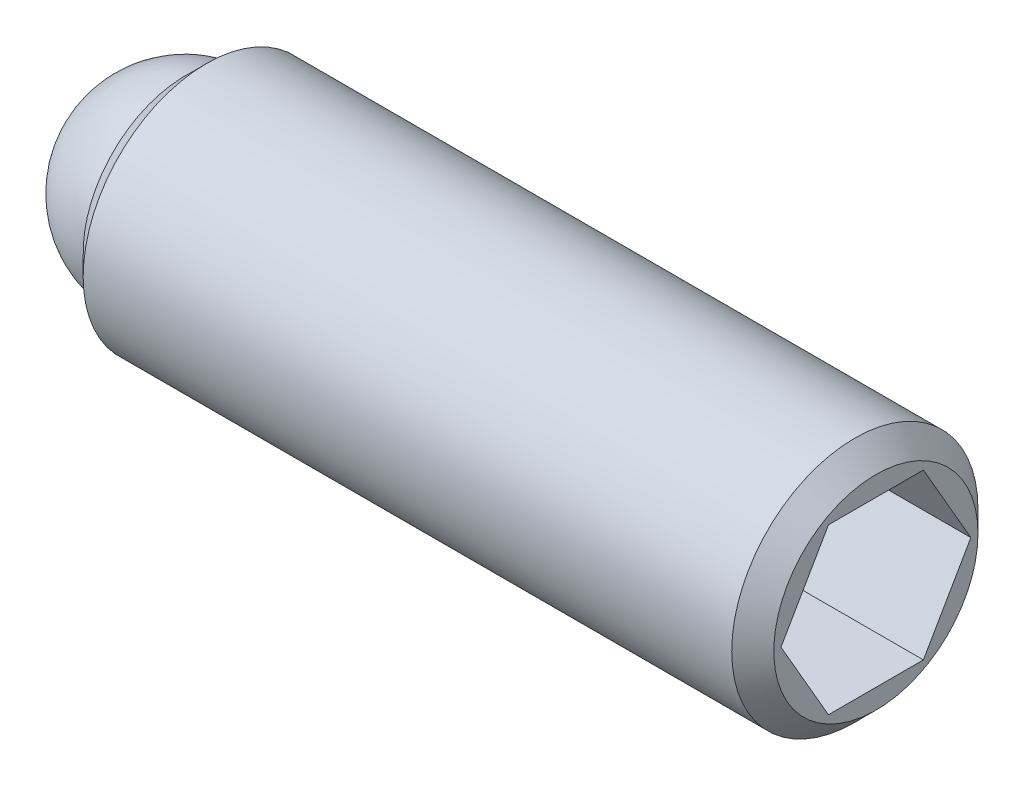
SolidWorks part; units mm, degrees
ref_plane "Front Plane" through (0, 0, 0) normal (0, 0, 1) x (1, 0, 0)
ref_plane "Top Plane" through (0, 0, 0) normal (0, 1, 0) x (1, 0, 0)
ref_plane "Right Plane" through (0, 0, 0) normal (1, 0, 0) x (0, 0, -1)
sketch "Sketch2" plane through (0, 0, 0) normal (1, 0, 0) x (0, 0, -1)
  circle A0 centre (0, 0) radius 1.4859
  dimension "D1" = 2.9718
extrude "Boss-Extrude1" add sketch "Sketch2" along normal blind 8.3344
sketch "Sketch3" plane through (0, 0, 0) normal (-1, 0, 0) x (0, 0, 1)
  circle A0 centre (0, 0) radius 1.1906
  dimension "D1" = 2.3813
chamfer "Chamfer1" distance 0.254 angle 45 1 edges at (0, 0, -1.4859)
chamfer "Chamfer2" distance 0.254 angle 45 1 edges at (8.3344, 0, -1.4859)
sketch "Sketch4" plane through (8.3344, 0, 0) normal (1, 0, 0) x (0, 0, -1)
  line L1 (1.1457, 0) -> (0.5728, 0.9922)
  line L2 (0.5728, 0.9922) -> (-0.5728, 0.9922)
  line L3 (-0.5728, 0.9922) -> (-1.1457, 0)
  line L4 (-1.1457, 0) -> (-0.5728, -0.9922)
  line L5 (-0.5728, -0.9922) -> (0.5728, -0.9922)
  line L6 (0.5728, -0.9922) -> (1.1457, 0)
  circle A0 centre (0, 0) radius 0.9922 construction
extrude "Cut-Extrude2" cut sketch "Sketch4" against normal blind 2.286
extrude "Cut-Extrude3" cut sketch "Sketch3" against normal blind 1.1906
sketch "Sketch5" plane through (0, 0, 0) normal (-1, 0, 0) x (0, 0, 1)
  line L0 (0, 0) -> (0, -1.1906)
  line L1 (0, 0) -> (0, 1.1906)
  arc A0 (0, 1.1906) -> (0, -1.1906) centre (0, 0) ccw
  dimension "D1" = 1.1906
revolve "Revolve1" add sketch "Sketch5" angle 360 about L1
